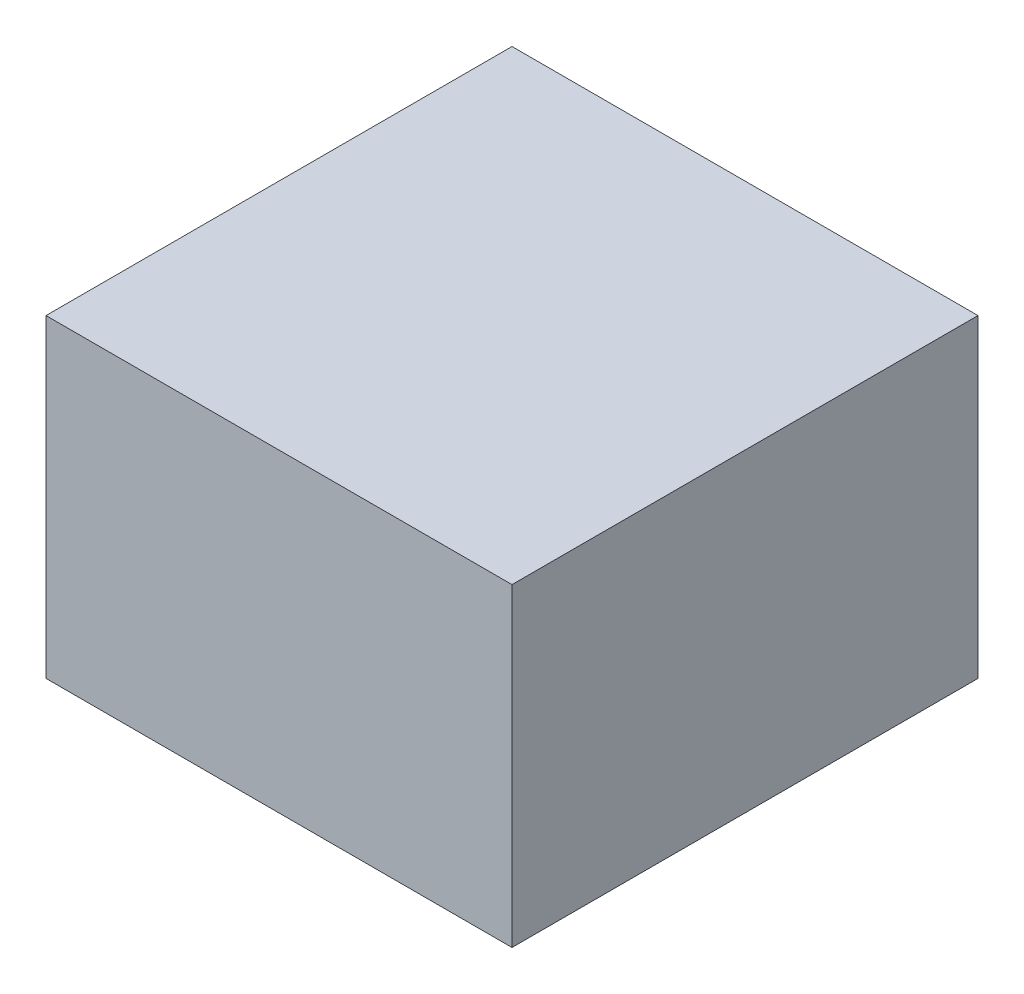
SolidWorks part; units mm, degrees
ref_plane "Front Plane" through (0, 0, 0) normal (0, 0, 1) x (1, 0, 0)
ref_plane "Top Plane" through (0, 0, 0) normal (0, 1, 0) x (1, 0, 0)
ref_plane "Right Plane" through (0, 0, 0) normal (1, 0, 0) x (0, 0, -1)
sketch "Sketch1" plane through (0, 0, 0) normal (0, 1, 0) x (1, 0, 0)
  line L1 (0, 0) -> (43, 0)
  line L2 (0, 0) -> (0, 43)
  line L3 (0, 43) -> (43, 43)
  line L4 (43, 0) -> (43, 43)
  dimension "D1" = 43
  dimension "D2" = 43
extrude "Boss-Extrude1" add sketch "Sketch1" along normal blind 29
